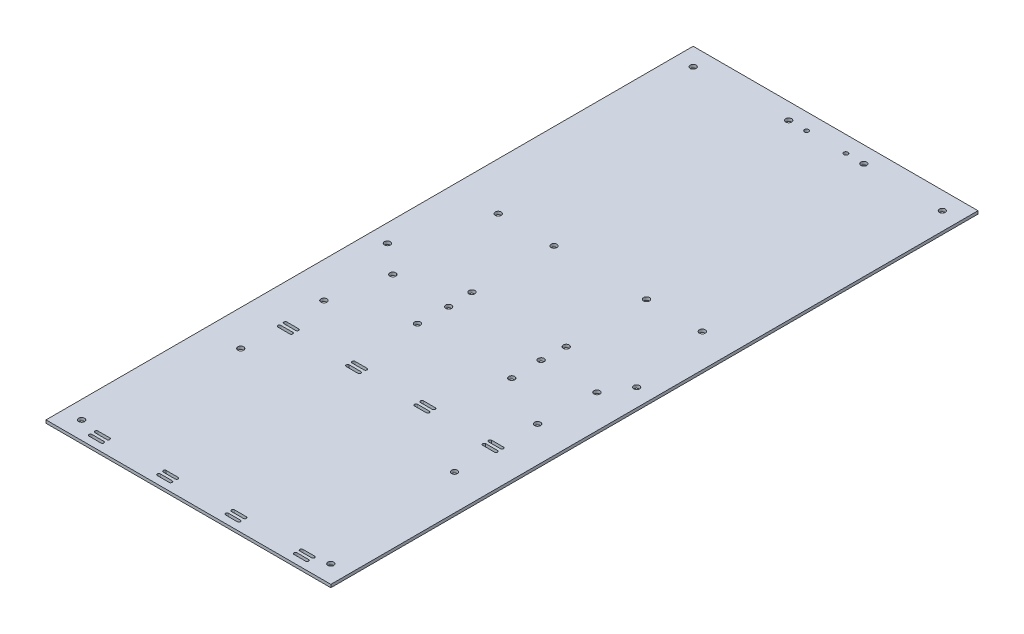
SolidWorks part; units mm, degrees
ref_plane "Front Plane" through (0, 0, 0) normal (0, 0, 1) x (1, 0, 0)
ref_plane "Top Plane" through (0, 0, 0) normal (0, 1, 0) x (1, 0, 0)
ref_plane "Right Plane" through (0, 0, 0) normal (1, 0, 0) x (0, 0, -1)
sketch "Sketch1" plane through (0, 277.5506, 0) normal (0, -1, 0) x (1, 0, 0)
  line L0 (-886.8029, 1369.3658) -> (-721.7029, 1369.3658) construction
  line L1 (-912.2029, 1394.7658) -> (-607.5404, 1394.7658)
  line L2 (-912.2029, 1394.7658) -> (-912.2029, 702.6158)
  line L3 (-912.2029, 702.6158) -> (-607.5404, 702.6158)
  line L4 (-607.5404, 1394.7658) -> (-607.5404, 702.6158)
  line L5 (-886.8029, 1314.9658) -> (-886.8029, 1369.3658) construction
  line L6 (-632.9404, 1369.3658) -> (-632.9404, 1313.3658) construction
  point P9 (-886.8029, 1342.1658)
  dimension "D1" = 25.4
  dimension "D2" = 25.4
  dimension "D3" = 25.4
  dimension "D4" = 692.15
extrude "Boss-Extrude1" add sketch "Sketch1" along normal blind 3.175
sketch "Sketch2" plane through (0, 277.5506, 0) normal (0, 1, 0) x (1, 0, 0)
  circle A0 centre (-861.4029, -961.9283) radius 3.175
  circle A1 centre (-801.7129, -961.9283) radius 3.175
  circle A2 centre (-861.4029, -1074.6408) radius 3.175
  circle A3 centre (-801.7129, -1074.6408) radius 3.175
  circle A4 centre (-802.6653, -1048.7283) radius 3.175
  circle A5 centre (-701.8154, -1048.7283) radius 3.175
  circle A6 centre (-702.7679, -961.9283) radius 3.175
  circle A7 centre (-643.0779, -961.9283) radius 3.175
  circle A8 centre (-643.0779, -1074.6408) radius 3.175
  circle A9 centre (-702.7679, -1074.6408) radius 3.175
  circle A10 centre (-701.8154, -1107.0283) radius 3.175
  circle A11 centre (-802.6653, -1107.0283) radius 3.175
  dimension "D1" = 6.35
  dimension "D2" = 6.35
extrude "Cut-Extrude1" cut sketch "Sketch2" against normal blind 3.175
sketch "Sketch4" plane through (-912.2029, 0, 0) normal (-1, 0, 0) x (0, 0, 1)
  line L0 (1394.7658, 274.3756) -> (1397.9408, 274.3756)
  line L1 (1397.9408, 274.3756) -> (1397.9408, 350.5756)
  line L2 (1397.9408, 350.5756) -> (1344.0592, 404.4572)
  line L3 (1344.0592, 404.4572) -> (1341.8142, 402.2121)
  line L4 (1341.8142, 402.2121) -> (1394.7658, 349.2605)
  line L5 (1394.7658, 349.2605) -> (1394.7658, 274.3756)
  line L6 (1394.7658, 349.2605) -> (1366.5868, 349.2605) construction
  dimension "D1" = 3.175
  dimension "D2" = 45
  dimension "D3" = 76.2
  dimension "D4" = 76.2
extrude "Boss-Extrude2" [suppressed] add sketch "Sketch4" against normal through all
sketch "Sketch5" [suppressed] plane through (0, 874.2582, 874.2582) normal (0, 0.7071, 0.7071) x (1, 0, 0)
  line L0 (-912.2029, -702.499) -> (-607.5404, -702.499) construction
  line L1 (-912.2029, -740.599) -> (-912.2029, -664.399) construction
  line L2 (-607.5404, -740.599) -> (-607.5404, -664.399) construction
  line L3 (-759.8716, -702.499) -> (-759.8716, -664.399) construction
  line L4 (-607.5404, -664.399) -> (-912.2029, -664.399) construction
  line L6 (-844.5716, -690.499) -> (-772.5716, -690.499)
  line L7 (-844.5716, -690.499) -> (-844.5716, -714.499)
  line L8 (-844.5716, -714.499) -> (-772.5716, -714.499)
  line L9 (-772.5716, -690.499) -> (-772.5716, -714.499)
  line L10 (-848.5716, -690.499) -> (-768.5716, -690.499) construction
  line L11 (-848.5716, -690.499) -> (-848.5716, -714.499) construction
  line L12 (-848.5716, -714.499) -> (-768.5716, -714.499) construction
  line L13 (-768.5716, -690.499) -> (-768.5716, -714.499) construction
  circle A0 centre (-747.1716, -686.624) radius 3
  circle A1 centre (-747.1716, -718.374) radius 3
  circle A2 centre (-734.4716, -702.499) radius 3
  circle A3 centre (-670.9716, -686.624) radius 3
  circle A4 centre (-670.9716, -718.374) radius 3
  circle A5 centre (-848.5716, -690.499) radius 1.25
  circle A6 centre (-848.5716, -714.499) radius 1.25
  circle A7 centre (-768.5716, -714.499) radius 1.25
  circle A8 centre (-768.5716, -690.499) radius 1.25
  circle A9 centre (-869.9716, -702.499) radius 3
  point P18 (-772.5716, -702.499)
  point P29 (-848.5716, -702.499)
  point P30 (-808.5716, -690.499)
  point P31 (-808.5716, -690.499)
  dimension "D1" = 6
  dimension "D5" = 6
  dimension "D6" = 6
  dimension "D13" = 2.5
  dimension "D14" = 6
  dimension "D2" = 12.7
  dimension "D3" = 15.875
  dimension "D4" = 12.7
  dimension "D7" = 76.2
  dimension "D8" = 12.7
  dimension "D9" = 72
  dimension "D10" = 24
  dimension "D11" = 80
  dimension "D12" = 24
  dimension "D15" = 25.4
extrude "Cut-Extrude2" [suppressed] cut sketch "Sketch5" against normal blind 3.175
sketch "Sketch6" [suppressed] plane through (0, 874.2582, 874.2582) normal (0, 0.7071, 0.7071) x (1, 0, 0)
  line L4 (-747.1716, -686.624) -> (-670.9716, -686.624) construction
  line L9 (-607.5404, -727.899) -> (-912.2029, -727.899) construction
  line L10 (-607.5404, -740.599) -> (-607.5404, -664.399) construction
  line L11 (-912.2029, -740.599) -> (-912.2029, -664.399) construction
  line L12 (-607.5404, -740.599) -> (-912.2029, -740.599) construction
  line L13 (-880.4529, -724.724) -> (-867.7529, -724.724) construction
  line L14 (-880.4529, -723.1365) -> (-867.7529, -723.1365)
  line L15 (-880.4529, -726.3115) -> (-867.7529, -726.3115)
  line L16 (-759.8716, -727.899) -> (-759.8716, -702.9885) construction
  line L17 (-880.4529, -731.074) -> (-867.7529, -731.074) construction
  line L18 (-880.4529, -732.6615) -> (-867.7529, -732.6615)
  line L19 (-880.4529, -729.4865) -> (-867.7529, -729.4865)
  line L20 (-802.2209, -724.724) -> (-789.5209, -724.724) construction
  line L21 (-802.2209, -723.1365) -> (-789.5209, -723.1365)
  line L22 (-802.2209, -726.3115) -> (-789.5209, -726.3115)
  line L23 (-802.2209, -731.074) -> (-789.5209, -731.074) construction
  line L24 (-802.2209, -732.6615) -> (-789.5209, -732.6615)
  line L25 (-802.2209, -729.4865) -> (-789.5209, -729.4865)
  line L26 (-723.9889, -724.724) -> (-711.2889, -724.724) construction
  line L27 (-723.9889, -723.1365) -> (-711.2889, -723.1365)
  line L28 (-723.9889, -726.3115) -> (-711.2889, -726.3115)
  line L29 (-723.9889, -731.074) -> (-711.2889, -731.074) construction
  line L30 (-723.9889, -732.6615) -> (-711.2889, -732.6615)
  line L31 (-723.9889, -729.4865) -> (-711.2889, -729.4865)
  line L32 (-645.7569, -724.724) -> (-633.0569, -724.724) construction
  line L33 (-645.7569, -723.1365) -> (-633.0569, -723.1365)
  line L34 (-645.7569, -726.3115) -> (-633.0569, -726.3115)
  line L35 (-645.7569, -731.074) -> (-633.0569, -731.074) construction
  line L36 (-645.7569, -732.6615) -> (-633.0569, -732.6615)
  line L37 (-645.7569, -729.4865) -> (-633.0569, -729.4865)
  arc A0 (-880.4529, -723.1365) -> (-880.4529, -726.3115) centre (-880.4529, -724.724) ccw
  arc A1 (-867.7529, -726.3115) -> (-867.7529, -723.1365) centre (-867.7529, -724.724) ccw
  arc A2 (-880.4529, -732.6615) -> (-880.4529, -729.4865) centre (-880.4529, -731.074) cw
  arc A3 (-867.7529, -729.4865) -> (-867.7529, -732.6615) centre (-867.7529, -731.074) cw
  arc A4 (-802.2209, -723.1365) -> (-802.2209, -726.3115) centre (-802.2209, -724.724) ccw
  arc A5 (-789.5209, -726.3115) -> (-789.5209, -723.1365) centre (-789.5209, -724.724) ccw
  arc A6 (-802.2209, -732.6615) -> (-802.2209, -729.4865) centre (-802.2209, -731.074) cw
  arc A7 (-789.5209, -729.4865) -> (-789.5209, -732.6615) centre (-789.5209, -731.074) cw
  arc A8 (-723.9889, -723.1365) -> (-723.9889, -726.3115) centre (-723.9889, -724.724) ccw
  arc A9 (-711.2889, -726.3115) -> (-711.2889, -723.1365) centre (-711.2889, -724.724) ccw
  arc A10 (-723.9889, -732.6615) -> (-723.9889, -729.4865) centre (-723.9889, -731.074) cw
  arc A11 (-711.2889, -729.4865) -> (-711.2889, -732.6615) centre (-711.2889, -731.074) cw
  arc A12 (-645.7569, -723.1365) -> (-645.7569, -726.3115) centre (-645.7569, -724.724) ccw
  arc A13 (-633.0569, -726.3115) -> (-633.0569, -723.1365) centre (-633.0569, -724.724) ccw
  arc A14 (-645.7569, -732.6615) -> (-645.7569, -729.4865) centre (-645.7569, -731.074) cw
  arc A15 (-633.0569, -729.4865) -> (-633.0569, -732.6615) centre (-633.0569, -731.074) cw
  point P15 (-874.1029, -724.724)
  point P24 (-874.1029, -731.074)
  point P33 (-795.8709, -724.724)
  point P40 (-795.8709, -731.074)
  point P47 (-717.6389, -724.724)
  point P54 (-717.6389, -731.074)
  point P61 (-639.4069, -724.724)
  point P68 (-639.4069, -731.074)
  dimension "D1" = 12.7
  dimension "D2" = 3.175
  dimension "D3" = 12.7
  dimension "D4" = 3.175
  dimension "D5" = 31.75
  dimension "D6" = 4
extrude "Cut-Extrude3" [suppressed] cut sketch "Sketch6" against normal blind 3.175
sketch "Sketch9" [suppressed] plane through (0, 0, 1397.9408) normal (0, 0, 1) x (1, 0, 0)
  line L0 (-912.2029, 312.4756) -> (-607.5404, 312.4756) construction
  line L1 (-912.2029, 274.3756) -> (-912.2029, 350.5756) construction
  line L2 (-607.5404, 274.3756) -> (-607.5404, 350.5756) construction
  line L3 (-912.2029, 293.4256) -> (-607.5404, 293.4256) construction
  text T0 "     IRON LUNG" font "Stencil" height 15.875
  text T1 "THE REAL     " font "Stencil" height 15.875
  dimension "D1" = 19.05
extrude "Cut-Extrude4" [suppressed] cut sketch "Sketch9" against normal blind 3.175
sketch "Sketch10" [suppressed] plane through (0, 274.3756, 0) normal (0, -1, 0) x (1, 0, 0)
  line L0 (-912.2029, 1385.2408) -> (-607.5404, 1385.2408) construction
  line L1 (-912.2029, 1397.9408) -> (-912.2029, 759.7658) construction
  line L2 (-607.5404, 759.7658) -> (-607.5404, 1397.9408) construction
  line L3 (-607.5404, 1397.9408) -> (-912.2029, 1397.9408) construction
  line L4 (-874.1029, 1388.4158) -> (-861.4029, 1388.4158) construction
  line L5 (-874.1029, 1390.0033) -> (-861.4029, 1390.0033)
  line L6 (-874.1029, 1386.8283) -> (-861.4029, 1386.8283)
  line L7 (-821.7789, 1388.4158) -> (-809.0789, 1388.4158) construction
  line L8 (-821.7789, 1390.0033) -> (-809.0789, 1390.0033)
  line L9 (-821.7789, 1386.8283) -> (-809.0789, 1386.8283)
  line L10 (-769.4549, 1388.4158) -> (-756.7549, 1388.4158) construction
  line L11 (-769.4549, 1390.0033) -> (-756.7549, 1390.0033)
  line L12 (-769.4549, 1386.8283) -> (-756.7549, 1386.8283)
  line L13 (-717.1309, 1388.4158) -> (-704.4309, 1388.4158) construction
  line L14 (-717.1309, 1390.0033) -> (-704.4309, 1390.0033)
  line L15 (-717.1309, 1386.8283) -> (-704.4309, 1386.8283)
  line L16 (-664.8069, 1388.4158) -> (-652.1069, 1388.4158) construction
  line L17 (-664.8069, 1390.0033) -> (-652.1069, 1390.0033)
  line L18 (-664.8069, 1386.8283) -> (-652.1069, 1386.8283)
  line L19 (-664.8069, 1382.0658) -> (-652.1069, 1382.0658) construction
  line L20 (-664.8069, 1380.4783) -> (-652.1069, 1380.4783)
  line L21 (-664.8069, 1383.6533) -> (-652.1069, 1383.6533)
  line L22 (-717.1309, 1382.0658) -> (-704.4309, 1382.0658) construction
  line L23 (-717.1309, 1380.4783) -> (-704.4309, 1380.4783)
  line L24 (-717.1309, 1383.6533) -> (-704.4309, 1383.6533)
  line L25 (-769.4549, 1382.0658) -> (-756.7549, 1382.0658) construction
  line L26 (-769.4549, 1380.4783) -> (-756.7549, 1380.4783)
  line L27 (-769.4549, 1383.6533) -> (-756.7549, 1383.6533)
  line L28 (-821.7789, 1382.0658) -> (-809.0789, 1382.0658) construction
  line L29 (-821.7789, 1380.4783) -> (-809.0789, 1380.4783)
  line L30 (-821.7789, 1383.6533) -> (-809.0789, 1383.6533)
  line L31 (-874.1029, 1382.0658) -> (-861.4029, 1382.0658) construction
  line L32 (-874.1029, 1380.4783) -> (-861.4029, 1380.4783)
  line L33 (-874.1029, 1383.6533) -> (-861.4029, 1383.6533)
  arc A0 (-874.1029, 1390.0033) -> (-874.1029, 1386.8283) centre (-874.1029, 1388.4158) ccw
  arc A1 (-861.4029, 1386.8283) -> (-861.4029, 1390.0033) centre (-861.4029, 1388.4158) ccw
  arc A2 (-821.7789, 1390.0033) -> (-821.7789, 1386.8283) centre (-821.7789, 1388.4158) ccw
  arc A3 (-809.0789, 1386.8283) -> (-809.0789, 1390.0033) centre (-809.0789, 1388.4158) ccw
  arc A4 (-769.4549, 1390.0033) -> (-769.4549, 1386.8283) centre (-769.4549, 1388.4158) ccw
  arc A5 (-756.7549, 1386.8283) -> (-756.7549, 1390.0033) centre (-756.7549, 1388.4158) ccw
  arc A6 (-717.1309, 1390.0033) -> (-717.1309, 1386.8283) centre (-717.1309, 1388.4158) ccw
  arc A7 (-704.4309, 1386.8283) -> (-704.4309, 1390.0033) centre (-704.4309, 1388.4158) ccw
  arc A8 (-664.8069, 1390.0033) -> (-664.8069, 1386.8283) centre (-664.8069, 1388.4158) ccw
  arc A9 (-652.1069, 1386.8283) -> (-652.1069, 1390.0033) centre (-652.1069, 1388.4158) ccw
  arc A10 (-664.8069, 1380.4783) -> (-664.8069, 1383.6533) centre (-664.8069, 1382.0658) cw
  arc A11 (-652.1069, 1383.6533) -> (-652.1069, 1380.4783) centre (-652.1069, 1382.0658) cw
  arc A12 (-717.1309, 1380.4783) -> (-717.1309, 1383.6533) centre (-717.1309, 1382.0658) cw
  arc A13 (-704.4309, 1383.6533) -> (-704.4309, 1380.4783) centre (-704.4309, 1382.0658) cw
  arc A14 (-769.4549, 1380.4783) -> (-769.4549, 1383.6533) centre (-769.4549, 1382.0658) cw
  arc A15 (-756.7549, 1383.6533) -> (-756.7549, 1380.4783) centre (-756.7549, 1382.0658) cw
  arc A16 (-821.7789, 1380.4783) -> (-821.7789, 1383.6533) centre (-821.7789, 1382.0658) cw
  arc A17 (-809.0789, 1383.6533) -> (-809.0789, 1380.4783) centre (-809.0789, 1382.0658) cw
  arc A18 (-874.1029, 1380.4783) -> (-874.1029, 1383.6533) centre (-874.1029, 1382.0658) cw
  arc A19 (-861.4029, 1383.6533) -> (-861.4029, 1380.4783) centre (-861.4029, 1382.0658) cw
  point P10 (-867.7529, 1388.4158)
  point P19 (-815.4289, 1388.4158)
  point P26 (-763.1049, 1388.4158)
  point P33 (-710.7809, 1388.4158)
  point P40 (-658.4569, 1388.4158)
  point P45 (-658.4569, 1382.0658)
  point P52 (-710.7809, 1382.0658)
  point P59 (-763.1049, 1382.0658)
  point P66 (-815.4289, 1382.0658)
  point P73 (-867.7529, 1382.0658)
  dimension "D2" = 1.5875
  dimension "D1" = 12.7
  dimension "D3" = 3.175
  dimension "D4" = 38.1
  dimension "D5" = 12.7
  dimension "D7" = 39.624
  dimension "D6" = 5
extrude "Cut-Extrude5" [suppressed] cut sketch "Sketch10" against normal blind 3.175
sketch "Sketch11" [suppressed] plane through (0, 0, 1397.9408) normal (0, 0, 1) x (1, 0, 0)
  line L0 (-886.8029, 350.5756) -> (-886.8029, 274.3756) construction
  line L1 (-607.5404, 350.5756) -> (-912.2029, 350.5756) construction
  line L2 (-607.5404, 274.3756) -> (-912.2029, 274.3756) construction
  line L3 (-889.9779, 318.8256) -> (-889.9779, 306.1256) construction
  line L4 (-888.3904, 318.8256) -> (-888.3904, 306.1256)
  line L5 (-891.5654, 318.8256) -> (-891.5654, 306.1256)
  line L6 (-912.2029, 274.3756) -> (-912.2029, 350.5756) construction
  line L7 (-883.6279, 318.8256) -> (-883.6279, 306.1256) construction
  line L8 (-885.2154, 318.8256) -> (-885.2154, 306.1256)
  line L9 (-882.0404, 318.8256) -> (-882.0404, 306.1256)
  line L10 (-759.8716, 350.5756) -> (-759.8716, 274.3756) construction
  line L11 (-636.1154, 318.8256) -> (-636.1154, 306.1256) construction
  line L12 (-634.5279, 318.8256) -> (-634.5279, 306.1256)
  line L13 (-637.7029, 318.8256) -> (-637.7029, 306.1256)
  line L14 (-629.7654, 318.8256) -> (-629.7654, 306.1256) construction
  line L15 (-631.3529, 318.8256) -> (-631.3529, 306.1256)
  line L16 (-628.1779, 318.8256) -> (-628.1779, 306.1256)
  arc A0 (-888.3904, 318.8256) -> (-891.5654, 318.8256) centre (-889.9779, 318.8256) ccw
  arc A1 (-891.5654, 306.1256) -> (-888.3904, 306.1256) centre (-889.9779, 306.1256) ccw
  arc A2 (-885.2154, 318.8256) -> (-882.0404, 318.8256) centre (-883.6279, 318.8256) cw
  arc A3 (-882.0404, 306.1256) -> (-885.2154, 306.1256) centre (-883.6279, 306.1256) cw
  arc A4 (-634.5279, 318.8256) -> (-637.7029, 318.8256) centre (-636.1154, 318.8256) ccw
  arc A5 (-637.7029, 306.1256) -> (-634.5279, 306.1256) centre (-636.1154, 306.1256) ccw
  arc A6 (-631.3529, 318.8256) -> (-628.1779, 318.8256) centre (-629.7654, 318.8256) cw
  arc A7 (-628.1779, 306.1256) -> (-631.3529, 306.1256) centre (-629.7654, 306.1256) cw
  point P8 (-889.9779, 312.4756)
  point P16 (-886.8029, 312.4756)
  point P19 (-883.6279, 312.4756)
  point P27 (-636.1154, 312.4756)
  point P34 (-629.7654, 312.4756)
  dimension "D1" = 3.175
  dimension "D2" = 3.175
  dimension "D3" = 25.4
  dimension "D4" = 12.7
extrude "Cut-Extrude6" [suppressed] cut sketch "Sketch11" against normal blind 3.175
sketch "Sketch12" plane through (0, 277.5506, 0) normal (0, 1, 0) x (1, 0, 0)
  line L0 (-912.2029, -1382.0658) -> (-607.5404, -1382.0658) construction
  line L1 (-912.2029, -1394.7658) -> (-912.2029, -702.6158) construction
  line L2 (-607.5404, -702.6158) -> (-607.5404, -1394.7658) construction
  line L4 (-874.1029, -1378.8908) -> (-861.4029, -1378.8908) construction
  line L5 (-874.1029, -1377.3033) -> (-861.4029, -1377.3033)
  line L6 (-874.1029, -1380.4783) -> (-861.4029, -1380.4783)
  line L7 (-801.0779, -1378.8908) -> (-788.3779, -1378.8908) construction
  line L8 (-801.0779, -1377.3033) -> (-788.3779, -1377.3033)
  line L9 (-801.0779, -1380.4783) -> (-788.3779, -1380.4783)
  line L10 (-728.0529, -1378.8908) -> (-715.3529, -1378.8908) construction
  line L11 (-728.0529, -1377.3033) -> (-715.3529, -1377.3033)
  line L12 (-728.0529, -1380.4783) -> (-715.3529, -1380.4783)
  line L13 (-655.0279, -1378.8908) -> (-642.3279, -1378.8908) construction
  line L14 (-655.0279, -1377.3033) -> (-642.3279, -1377.3033)
  line L15 (-655.0279, -1380.4783) -> (-642.3279, -1380.4783)
  line L16 (-655.0279, -1385.2408) -> (-642.3279, -1385.2408) construction
  line L17 (-655.0279, -1386.8283) -> (-642.3279, -1386.8283)
  line L18 (-655.0279, -1383.6533) -> (-642.3279, -1383.6533)
  line L19 (-728.0529, -1385.2408) -> (-715.3529, -1385.2408) construction
  line L20 (-728.0529, -1386.8283) -> (-715.3529, -1386.8283)
  line L21 (-728.0529, -1383.6533) -> (-715.3529, -1383.6533)
  line L22 (-801.0779, -1385.2408) -> (-788.3779, -1385.2408) construction
  line L23 (-801.0779, -1386.8283) -> (-788.3779, -1386.8283)
  line L24 (-801.0779, -1383.6533) -> (-788.3779, -1383.6533)
  line L25 (-874.1029, -1385.2408) -> (-861.4029, -1385.2408) construction
  line L26 (-874.1029, -1386.8283) -> (-861.4029, -1386.8283)
  line L27 (-874.1029, -1383.6533) -> (-861.4029, -1383.6533)
  line L28 (-607.5404, -1394.7658) -> (-912.2029, -1394.7658) construction
  arc A0 (-874.1029, -1377.3033) -> (-874.1029, -1380.4783) centre (-874.1029, -1378.8908) ccw
  arc A1 (-861.4029, -1380.4783) -> (-861.4029, -1377.3033) centre (-861.4029, -1378.8908) ccw
  arc A2 (-801.0779, -1377.3033) -> (-801.0779, -1380.4783) centre (-801.0779, -1378.8908) ccw
  arc A3 (-788.3779, -1380.4783) -> (-788.3779, -1377.3033) centre (-788.3779, -1378.8908) ccw
  arc A4 (-728.0529, -1377.3033) -> (-728.0529, -1380.4783) centre (-728.0529, -1378.8908) ccw
  arc A5 (-715.3529, -1380.4783) -> (-715.3529, -1377.3033) centre (-715.3529, -1378.8908) ccw
  arc A6 (-655.0279, -1377.3033) -> (-655.0279, -1380.4783) centre (-655.0279, -1378.8908) ccw
  arc A7 (-642.3279, -1380.4783) -> (-642.3279, -1377.3033) centre (-642.3279, -1378.8908) ccw
  arc A8 (-655.0279, -1386.8283) -> (-655.0279, -1383.6533) centre (-655.0279, -1385.2408) cw
  arc A9 (-642.3279, -1383.6533) -> (-642.3279, -1386.8283) centre (-642.3279, -1385.2408) cw
  arc A10 (-728.0529, -1386.8283) -> (-728.0529, -1383.6533) centre (-728.0529, -1385.2408) cw
  arc A11 (-715.3529, -1383.6533) -> (-715.3529, -1386.8283) centre (-715.3529, -1385.2408) cw
  arc A12 (-801.0779, -1386.8283) -> (-801.0779, -1383.6533) centre (-801.0779, -1385.2408) cw
  arc A13 (-788.3779, -1383.6533) -> (-788.3779, -1386.8283) centre (-788.3779, -1385.2408) cw
  arc A14 (-874.1029, -1386.8283) -> (-874.1029, -1383.6533) centre (-874.1029, -1385.2408) cw
  arc A15 (-861.4029, -1383.6533) -> (-861.4029, -1386.8283) centre (-861.4029, -1385.2408) cw
  point P10 (-867.7529, -1378.8908)
  point P18 (-794.7279, -1378.8908)
  point P25 (-721.7029, -1378.8908)
  point P32 (-648.6779, -1378.8908)
  point P38 (-648.6779, -1385.2408)
  point P45 (-721.7029, -1385.2408)
  point P52 (-794.7279, -1385.2408)
  point P59 (-867.7529, -1385.2408)
  dimension "D1" = 12.7
  dimension "D2" = 38.1
  dimension "D3" = 3.175
  dimension "D4" = 12.7
  dimension "D5" = 3.175
  dimension "D7" = 34.7875
  dimension "D6" = 4
extrude "Cut-Extrude7" cut sketch "Sketch12" against normal blind 3.175
sketch "Sketch13" plane through (0, 277.5506, 0) normal (0, 1, 0) x (1, 0, 0)
  line L0 (-759.8716, -702.6158) -> (-759.8716, -1394.7658) construction
  line L1 (-874.1716, -1135.6033) -> (-645.5716, -1135.6033) construction
  line L2 (-874.1716, -1135.6033) -> (-874.1716, -1224.5033) construction
  line L3 (-874.1716, -1224.5033) -> (-645.5716, -1224.5033) construction
  line L4 (-645.5716, -1135.6033) -> (-645.5716, -1224.5033) construction
  line L5 (-912.2029, -702.6158) -> (-607.5404, -702.6158) construction
  line L6 (-607.5404, -1394.7658) -> (-912.2029, -1394.7658) construction
  line L7 (-780.4404, -1113.3783) -> (-802.6653, -1113.3783) construction
  circle A0 centre (-874.1716, -1135.6033) radius 3.175
  circle A1 centre (-645.5716, -1135.6033) radius 3.175
  circle A2 centre (-645.5716, -1224.5033) radius 3.175
  circle A3 centre (-874.1716, -1224.5033) radius 3.175
  point P10 (-759.8716, -1135.6033)
  dimension "D4" = 6.35
  dimension "D1" = 228.6
  dimension "D2" = 88.9
  dimension "D3" = 22.225
extrude "Cut-Extrude8" cut sketch "Sketch13" against normal blind 12.7
sketch "Sketch14" plane through (0, 277.5506, 0) normal (0, 1, 0) x (1, 0, 0)
  line L0 (-874.1716, -1135.6033) -> (-874.1716, -1224.5033) construction
  line L1 (-645.5716, -1135.6033) -> (-645.5716, -1224.5033) construction
  line L2 (-874.1716, -1180.0533) -> (-645.5716, -1180.0533) construction
  line L3 (-874.1029, -1386.8283) -> (-861.4029, -1386.8283) construction
  line L4 (-642.3279, -1183.2283) -> (-642.3279, -1176.8783) construction
  line L5 (-874.1029, -1183.2283) -> (-874.1029, -1176.8783) construction
  line L6 (-874.1029, -1181.6408) -> (-861.4029, -1181.6408)
  line L7 (-861.4029, -1184.8158) -> (-874.1029, -1184.8158)
  line L8 (-861.4029, -1178.4658) -> (-874.1029, -1178.4658)
  line L9 (-874.1029, -1175.2908) -> (-861.4029, -1175.2908)
  line L10 (-801.0779, -1175.2908) -> (-788.3779, -1175.2908)
  line L11 (-788.3779, -1178.4658) -> (-801.0779, -1178.4658)
  line L12 (-788.3779, -1184.8158) -> (-801.0779, -1184.8158)
  line L13 (-801.0779, -1181.6408) -> (-788.3779, -1181.6408)
  line L14 (-728.0529, -1181.6408) -> (-715.3529, -1181.6408)
  line L15 (-715.3529, -1184.8158) -> (-728.0529, -1184.8158)
  line L16 (-715.3529, -1178.4658) -> (-728.0529, -1178.4658)
  line L17 (-728.0529, -1175.2908) -> (-715.3529, -1175.2908)
  line L18 (-655.0279, -1175.2908) -> (-642.3279, -1175.2908)
  line L19 (-655.0279, -1386.8283) -> (-642.3279, -1386.8283) construction
  line L20 (-642.3279, -1383.6533) -> (-655.0279, -1383.6533) construction
  line L21 (-861.4029, -1383.6533) -> (-874.1029, -1383.6533) construction
  line L22 (-861.4029, -1377.3033) -> (-874.1029, -1377.3033) construction
  line L23 (-874.1029, -1380.4783) -> (-861.4029, -1380.4783) construction
  line L24 (-788.3779, -1377.3033) -> (-801.0779, -1377.3033) construction
  line L25 (-801.0779, -1380.4783) -> (-788.3779, -1380.4783) construction
  line L26 (-788.3779, -1383.6533) -> (-801.0779, -1383.6533) construction
  line L27 (-801.0779, -1386.8283) -> (-788.3779, -1386.8283) construction
  line L28 (-715.3529, -1383.6533) -> (-728.0529, -1383.6533) construction
  line L29 (-728.0529, -1386.8283) -> (-715.3529, -1386.8283) construction
  line L30 (-728.0529, -1380.4783) -> (-715.3529, -1380.4783) construction
  line L31 (-715.3529, -1377.3033) -> (-728.0529, -1377.3033) construction
  line L32 (-655.0279, -1380.4783) -> (-642.3279, -1380.4783) construction
  line L33 (-642.3279, -1377.3033) -> (-655.0279, -1377.3033) construction
  line L34 (-655.0279, -1380.4783) -> (-642.3279, -1380.4783) construction
  line L35 (-642.3279, -1377.3033) -> (-655.0279, -1377.3033) construction
  line L36 (-642.3279, -1383.6533) -> (-655.0279, -1383.6533) construction
  line L37 (-655.0279, -1386.8283) -> (-642.3279, -1386.8283) construction
  line L38 (-728.0529, -1386.8283) -> (-715.3529, -1386.8283) construction
  line L39 (-715.3529, -1383.6533) -> (-728.0529, -1383.6533) construction
  line L40 (-715.3529, -1377.3033) -> (-728.0529, -1377.3033) construction
  line L41 (-728.0529, -1380.4783) -> (-715.3529, -1380.4783) construction
  line L42 (-801.0779, -1380.4783) -> (-788.3779, -1380.4783) construction
  line L43 (-788.3779, -1377.3033) -> (-801.0779, -1377.3033) construction
  line L44 (-788.3779, -1383.6533) -> (-801.0779, -1383.6533) construction
  line L45 (-801.0779, -1386.8283) -> (-788.3779, -1386.8283) construction
  line L46 (-874.1029, -1386.8283) -> (-861.4029, -1386.8283) construction
  line L47 (-861.4029, -1383.6533) -> (-874.1029, -1383.6533) construction
  line L48 (-861.4029, -1377.3033) -> (-874.1029, -1377.3033) construction
  line L49 (-874.1029, -1380.4783) -> (-861.4029, -1380.4783) construction
  line L50 (-874.1029, -1378.8908) -> (-874.1029, -1385.2408) construction
  line L51 (-642.3279, -1378.8908) -> (-642.3279, -1385.2408) construction
  line L52 (-642.3279, -1382.0658) -> (-874.1029, -1382.0658) construction
  line L53 (-874.1029, -1382.0658) -> (-874.1716, -1180.0533) construction
  line L54 (-874.1372, -1281.0595) -> (-539.3472, -1281.0595) construction
  line L55 (-642.3279, -1178.4658) -> (-655.0279, -1178.4658)
  line L56 (-642.3279, -1184.8158) -> (-655.0279, -1184.8158)
  line L57 (-655.0279, -1181.6408) -> (-642.3279, -1181.6408)
  arc A0 (-874.1029, -1184.8158) -> (-874.1029, -1181.6408) centre (-874.1029, -1183.2283) cw
  arc A1 (-861.4029, -1181.6408) -> (-861.4029, -1184.8158) centre (-861.4029, -1183.2283) cw
  arc A2 (-861.4029, -1175.2908) -> (-861.4029, -1178.4658) centre (-861.4029, -1176.8783) cw
  arc A3 (-874.1029, -1178.4658) -> (-874.1029, -1175.2908) centre (-874.1029, -1176.8783) cw
  arc A4 (-801.0779, -1178.4658) -> (-801.0779, -1175.2908) centre (-801.0779, -1176.8783) cw
  arc A5 (-788.3779, -1175.2908) -> (-788.3779, -1178.4658) centre (-788.3779, -1176.8783) cw
  arc A6 (-788.3779, -1181.6408) -> (-788.3779, -1184.8158) centre (-788.3779, -1183.2283) cw
  arc A7 (-801.0779, -1184.8158) -> (-801.0779, -1181.6408) centre (-801.0779, -1183.2283) cw
  arc A8 (-728.0529, -1184.8158) -> (-728.0529, -1181.6408) centre (-728.0529, -1183.2283) cw
  arc A9 (-715.3529, -1181.6408) -> (-715.3529, -1184.8158) centre (-715.3529, -1183.2283) cw
  arc A10 (-715.3529, -1175.2908) -> (-715.3529, -1178.4658) centre (-715.3529, -1176.8783) cw
  arc A11 (-728.0529, -1178.4658) -> (-728.0529, -1175.2908) centre (-728.0529, -1176.8783) cw
  arc A12 (-655.0279, -1178.4658) -> (-655.0279, -1175.2908) centre (-655.0279, -1176.8783) cw
  arc A13 (-642.3279, -1175.2908) -> (-642.3279, -1178.4658) centre (-642.3279, -1176.8783) cw
  arc A14 (-642.3279, -1181.6408) -> (-642.3279, -1184.8158) centre (-642.3279, -1183.2283) cw
  arc A15 (-655.0279, -1184.8158) -> (-655.0279, -1181.6408) centre (-655.0279, -1183.2283) cw
  arc A16 (-642.3279, -1386.8283) -> (-642.3279, -1383.6533) centre (-642.3279, -1385.2408) ccw construction
  arc A17 (-655.0279, -1383.6533) -> (-655.0279, -1386.8283) centre (-655.0279, -1385.2408) ccw construction
  arc A18 (-861.4029, -1386.8283) -> (-861.4029, -1383.6533) centre (-861.4029, -1385.2408) ccw construction
  arc A19 (-874.1029, -1383.6533) -> (-874.1029, -1386.8283) centre (-874.1029, -1385.2408) ccw construction
  arc A20 (-874.1029, -1377.3033) -> (-874.1029, -1380.4783) centre (-874.1029, -1378.8908) ccw construction
  arc A21 (-861.4029, -1380.4783) -> (-861.4029, -1377.3033) centre (-861.4029, -1378.8908) ccw construction
  arc A22 (-801.0779, -1377.3033) -> (-801.0779, -1380.4783) centre (-801.0779, -1378.8908) ccw construction
  arc A23 (-788.3779, -1380.4783) -> (-788.3779, -1377.3033) centre (-788.3779, -1378.8908) ccw construction
  arc A24 (-801.0779, -1383.6533) -> (-801.0779, -1386.8283) centre (-801.0779, -1385.2408) ccw construction
  arc A25 (-788.3779, -1386.8283) -> (-788.3779, -1383.6533) centre (-788.3779, -1385.2408) ccw construction
  arc A26 (-728.0529, -1383.6533) -> (-728.0529, -1386.8283) centre (-728.0529, -1385.2408) ccw construction
  arc A27 (-715.3529, -1386.8283) -> (-715.3529, -1383.6533) centre (-715.3529, -1385.2408) ccw construction
  arc A28 (-715.3529, -1380.4783) -> (-715.3529, -1377.3033) centre (-715.3529, -1378.8908) ccw construction
  arc A29 (-728.0529, -1377.3033) -> (-728.0529, -1380.4783) centre (-728.0529, -1378.8908) ccw construction
  arc A30 (-655.0279, -1377.3033) -> (-655.0279, -1380.4783) centre (-655.0279, -1378.8908) ccw construction
  arc A31 (-642.3279, -1380.4783) -> (-642.3279, -1377.3033) centre (-642.3279, -1378.8908) ccw construction
  arc A32 (-655.0279, -1377.3033) -> (-655.0279, -1380.4783) centre (-655.0279, -1378.8908) ccw construction
  arc A33 (-642.3279, -1380.4783) -> (-642.3279, -1377.3033) centre (-642.3279, -1378.8908) ccw construction
  arc A34 (-642.3279, -1386.8283) -> (-642.3279, -1383.6533) centre (-642.3279, -1385.2408) ccw construction
  arc A35 (-655.0279, -1383.6533) -> (-655.0279, -1386.8283) centre (-655.0279, -1385.2408) ccw construction
  arc A36 (-728.0529, -1383.6533) -> (-728.0529, -1386.8283) centre (-728.0529, -1385.2408) ccw construction
  arc A37 (-715.3529, -1386.8283) -> (-715.3529, -1383.6533) centre (-715.3529, -1385.2408) ccw construction
  arc A38 (-715.3529, -1380.4783) -> (-715.3529, -1377.3033) centre (-715.3529, -1378.8908) ccw construction
  arc A39 (-728.0529, -1377.3033) -> (-728.0529, -1380.4783) centre (-728.0529, -1378.8908) ccw construction
  arc A40 (-801.0779, -1377.3033) -> (-801.0779, -1380.4783) centre (-801.0779, -1378.8908) ccw construction
  arc A41 (-788.3779, -1380.4783) -> (-788.3779, -1377.3033) centre (-788.3779, -1378.8908) ccw construction
  arc A42 (-788.3779, -1386.8283) -> (-788.3779, -1383.6533) centre (-788.3779, -1385.2408) ccw construction
  arc A43 (-801.0779, -1383.6533) -> (-801.0779, -1386.8283) centre (-801.0779, -1385.2408) ccw construction
  arc A44 (-874.1029, -1383.6533) -> (-874.1029, -1386.8283) centre (-874.1029, -1385.2408) ccw construction
  arc A45 (-861.4029, -1386.8283) -> (-861.4029, -1383.6533) centre (-861.4029, -1385.2408) ccw construction
  arc A46 (-861.4029, -1380.4783) -> (-861.4029, -1377.3033) centre (-861.4029, -1378.8908) ccw construction
  arc A47 (-874.1029, -1377.3033) -> (-874.1029, -1380.4783) centre (-874.1029, -1378.8908) ccw construction
extrude "Cut-Extrude9" cut sketch "Sketch14" against normal through all
sketch "Sketch15" plane through (0, 277.5506, 0) normal (0, 1, 0) x (1, 0, 0)
  circle A0 centre (-773.2404, -720.1875) radius 2.25
  circle A1 centre (-731.2404, -720.1875) radius 2.25
  dimension "D1" = 4.5
  dimension "D2" = 4.5
extrude "Cut-Extrude10" cut sketch "Sketch15" against normal through all
sketch "Sketch16" plane through (0, 274.3756, 0) normal (0, -1, 0) x (1, 0, 0)
  line L0 (-912.2029, 1394.7658) -> (-912.2029, 702.6158) construction
  line L1 (-893.1529, 1375.7158) -> (-626.5904, 1375.7158) construction
  line L2 (-893.1529, 1375.7158) -> (-893.1529, 721.6658) construction
  line L3 (-893.1529, 721.6658) -> (-626.5904, 721.6658) construction
  line L4 (-626.5904, 1375.7158) -> (-626.5904, 721.6658) construction
  line L5 (-607.5404, 1394.7658) -> (-912.2029, 1394.7658) construction
  line L6 (-607.5404, 702.6158) -> (-607.5404, 1394.7658) construction
  line L7 (-912.2029, 702.6158) -> (-607.5404, 702.6158) construction
  circle A0 centre (-893.1529, 1375.7158) radius 3.175
  circle A1 centre (-626.5904, 1375.7158) radius 3.175
  circle A2 centre (-626.5904, 721.6658) radius 3.175
  circle A3 centre (-893.1529, 721.6658) radius 3.175
  dimension "D5" = 6.35
  dimension "D1" = 19.05
  dimension "D2" = 19.05
  dimension "D3" = 19.05
  dimension "D4" = 19.05
extrude "Cut-Extrude11" cut sketch "Sketch16" against normal through all
sketch "Sketch17" plane through (0, 277.5506, 0) normal (0, 1, 0) x (1, 0, 0)
  circle A0 centre (-792.4404, -720.1875) radius 3.175
  circle A1 centre (-712.0404, -720.1875) radius 3.175
  dimension "D1" = 6.35
  dimension "D2" = 6.35
extrude "Cut-Extrude12" cut sketch "Sketch17" against normal through all
sketch "Sketch18" plane through (0, 274.3756, 0) normal (0, -1, 0) x (1, 0, 0)
  line L0 (-893.1529, 1375.7158) -> (-893.1529, 721.6658) construction
  line L1 (-626.5904, 721.6658) -> (-626.5904, 1375.7158) construction
  circle A0 centre (-893.1529, 1048.6908) radius 3.175
  circle A1 centre (-626.5904, 1048.6908) radius 3.175
  dimension "D1" = 6.35
  dimension "D2" = 6.35
extrude "Cut-Extrude13" cut sketch "Sketch18" against normal through all
